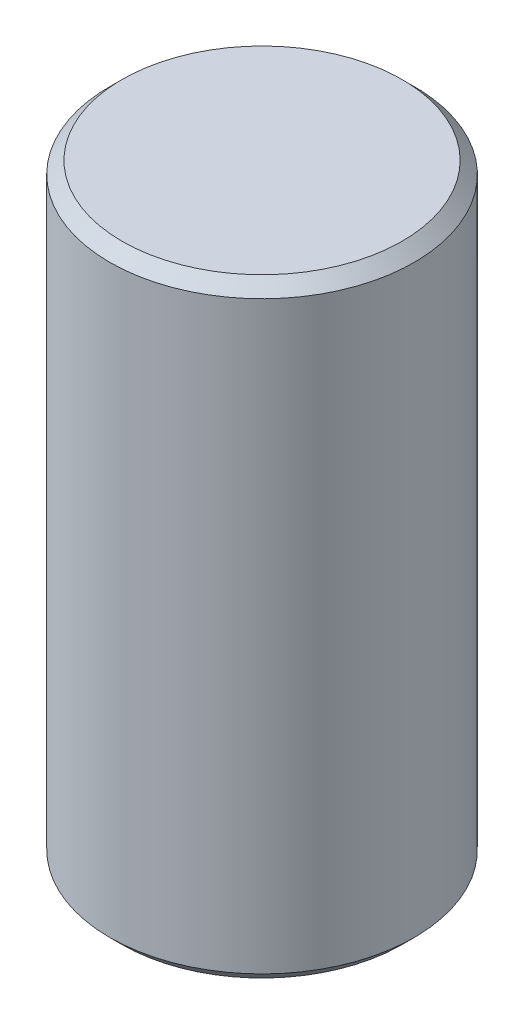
SolidWorks part; units mm, degrees
ref_plane "Front Plane" through (0, 0, 0) normal (0, 0, 1) x (1, 0, 0)
ref_plane "Top Plane" through (0, 0, 0) normal (0, 1, 0) x (1, 0, 0)
ref_plane "Right Plane" through (0, 0, 0) normal (1, 0, 0) x (0, 0, -1)
sketch "Sketch1" plane through (0, 0, 0) normal (0, 1, 0) x (1, 0, 0)
  circle A0 centre (0, 0) radius 1.25
  dimension "D1" = 2.5
extrude "Boss-Extrude1" add sketch "Sketch1" along normal blind 5
chamfer "Chamfer1" distance 0.1 angle 45 2 edges at (0, 0, 1.25) (0, 5, 1.25)
